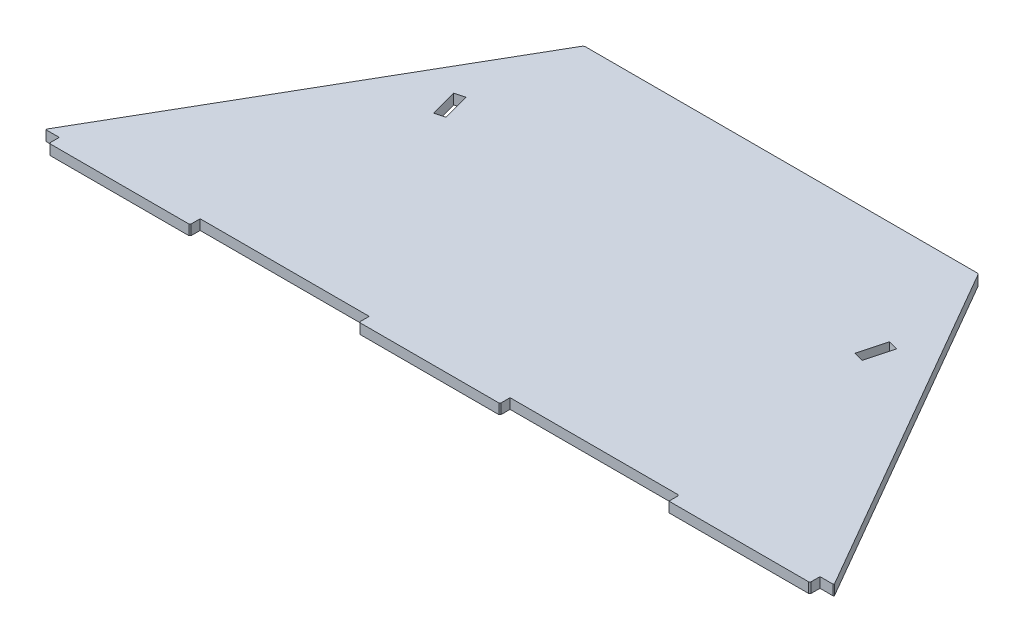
SolidWorks part; units mm, degrees
ref_plane "Alzado" through (0, 0, 0) normal (0, 0, 1) x (1, 0, 0)
ref_plane "Planta" through (0, 0, 0) normal (0, 1, 0) x (1, 0, 0)
ref_plane "Vista lateral" through (0, 0, 0) normal (1, 0, 0) x (0, 0, -1)
sketch "Croquis1" plane through (0, 0, 0) normal (0, 1, 0) x (1, 0, 0)
  line L0 (0, 0) -> (0, 606.2178) construction
  line L1 (350, 606.2178) -> (-350, 606.2178)
  line L2 (-350, 606.2178) -> (-700, 0)
  line L3 (-700, 0) -> (-350, -606.2178)
  line L4 (-350, -606.2178) -> (350, -606.2178)
  line L5 (350, -606.2178) -> (700, 0)
  line L6 (700, 0) -> (350, 606.2178)
  circle A0 centre (0, 0) radius 606.2178 construction
  dimension "D1" = 1400
extrude "Saliente-Extruir1" add sketch "Croquis1" along normal blind 18
sketch "Croquis2" plane through (0, 18, 0) normal (0, 1, 0) x (1, 0, 0)
  line L0 (700, 0) -> (350, 606.2178) construction
  line L1 (-700, 0) -> (700, 0)
  line L2 (-700, 0) -> (-700, -606.2178)
  line L3 (-700, -606.2178) -> (700, -606.2178)
  line L4 (700, 0) -> (700, -606.2178)
  line L5 (-350, -606.2178) -> (350, -606.2178) construction
extrude "Cortar-Extruir1" cut sketch "Croquis2" against normal through all
sketch "Croquis3" plane through (0, 18, 0) normal (0, 1, 0) x (1, 0, 0)
  line L0 (700, 0) -> (-700, 0) construction
  line L1 (-675, 0) -> (-425, 0)
  line L2 (-675, 0) -> (-675, -18)
  line L3 (-675, -18) -> (-425, -18)
  line L4 (-425, 0) -> (-425, -18)
  line L5 (0, -18) -> (0, 0) construction
  line L6 (-125, 0) -> (125, 0)
  line L7 (-125, 0) -> (-125, -18)
  line L8 (-125, -18) -> (125, -18)
  line L9 (125, 0) -> (125, -18)
  line L10 (425, 0) -> (675, 0)
  line L11 (425, 0) -> (425, -18)
  line L12 (425, -18) -> (675, -18)
  line L13 (675, 0) -> (675, -18)
  point P17 (425, -9)
  dimension "D1" = 250
  dimension "D2" = 250
  dimension "D3" = 250
  dimension "D4" = 300
  dimension "D5" = 300
  dimension "D6" = 18
extrude "Saliente-Extruir2" add sketch "Croquis3" against normal through all
sketch "Croquis4" plane through (0, 0, 0) normal (0, -1, 0) x (1, 0, 0)
  line L0 (0, 0) -> (0, -606.2178) construction
  line L5 (350, -606.2178) -> (-350, -606.2178) construction
  line L29 (-375.604, -422.5257) -> (-392.9906, -417.867)
  line L30 (-392.9906, -417.867) -> (-380.0497, -369.5707)
  line L31 (-380.0497, -369.5707) -> (-362.663, -374.2294)
  line L32 (-362.663, -374.2294) -> (-375.604, -422.5257)
  line L33 (362.663, -374.2294) -> (375.604, -422.5257)
  line L34 (380.0497, -369.5707) -> (362.663, -374.2294)
  line L35 (392.9906, -417.867) -> (380.0497, -369.5707)
  line L36 (375.604, -422.5257) -> (392.9906, -417.867)
extrude "Cortar-Extruir2" cut sketch "Croquis4" against normal through all
fillet "Redondeo1" radius 5 2 edges at (350, 9, -606.2178) (-350, 9, -606.2178)
chamfer "Chaflán1" distance 2 angle 45 8 edges at (700, 9, 0) (675, 9, 18) (425, 9, 0) (125, 9, 18) (-125, 9, 18) (-700, 9, 0) (-425, 9, 18) (-675, 9, 18)
